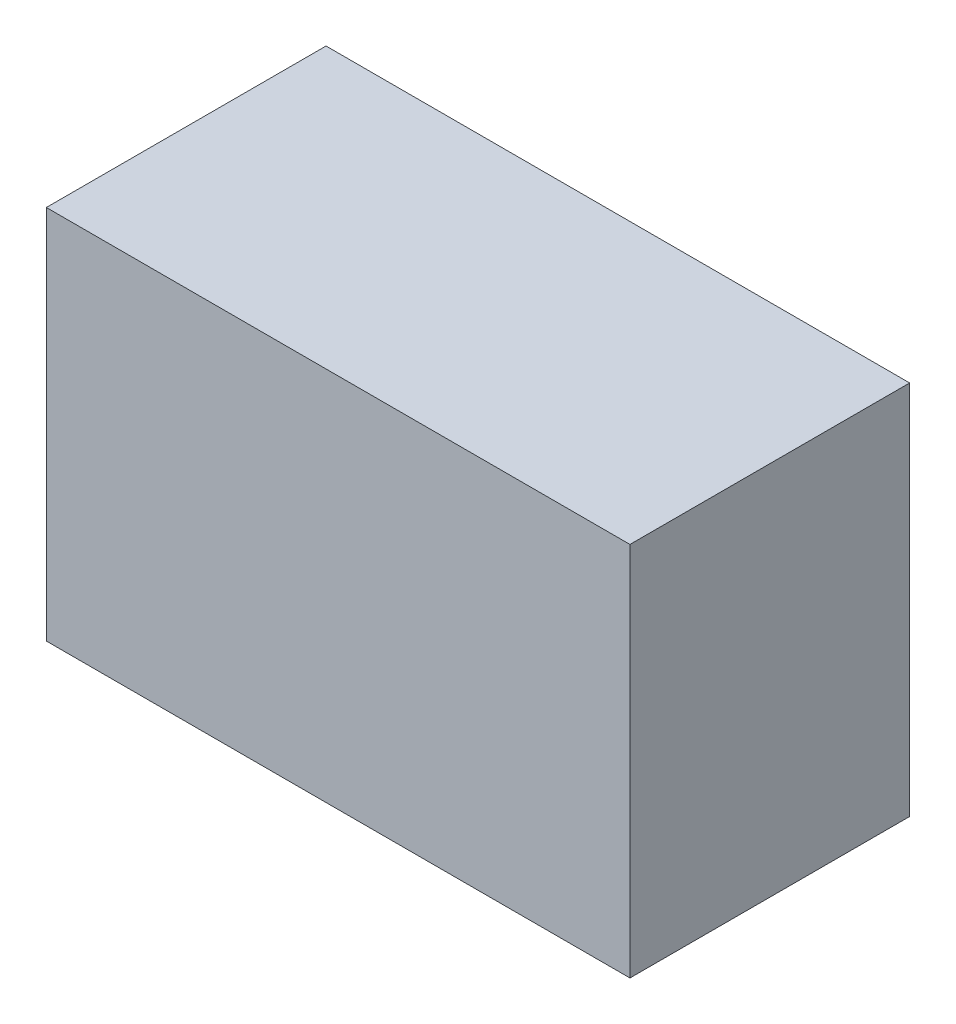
SolidWorks part; units mm, degrees
ref_plane "Front Plane" through (0, 0, 0) normal (0, 0, 1) x (1, 0, 0)
ref_plane "Top Plane" through (0, 0, 0) normal (0, 1, 0) x (1, 0, 0)
ref_plane "Right Plane" through (0, 0, 0) normal (1, 0, 0) x (0, 0, -1)
sketch "GENERAL" plane through (0, 0, 0) normal (0, 0, 1) x (1, 0, 0)
  line L16 (-2.75, -1.71) -> (2.55, -1.71)
  line L17 (2.55, -1.71) -> (2.55, 1.7)
  line L18 (2.55, 1.7) -> (-2.75, 1.7)
  line L19 (-2.75, 1.7) -> (-2.75, -1.71)
extrude "Boss-Extrude1" add sketch "GENERAL" along normal blind 2.54
